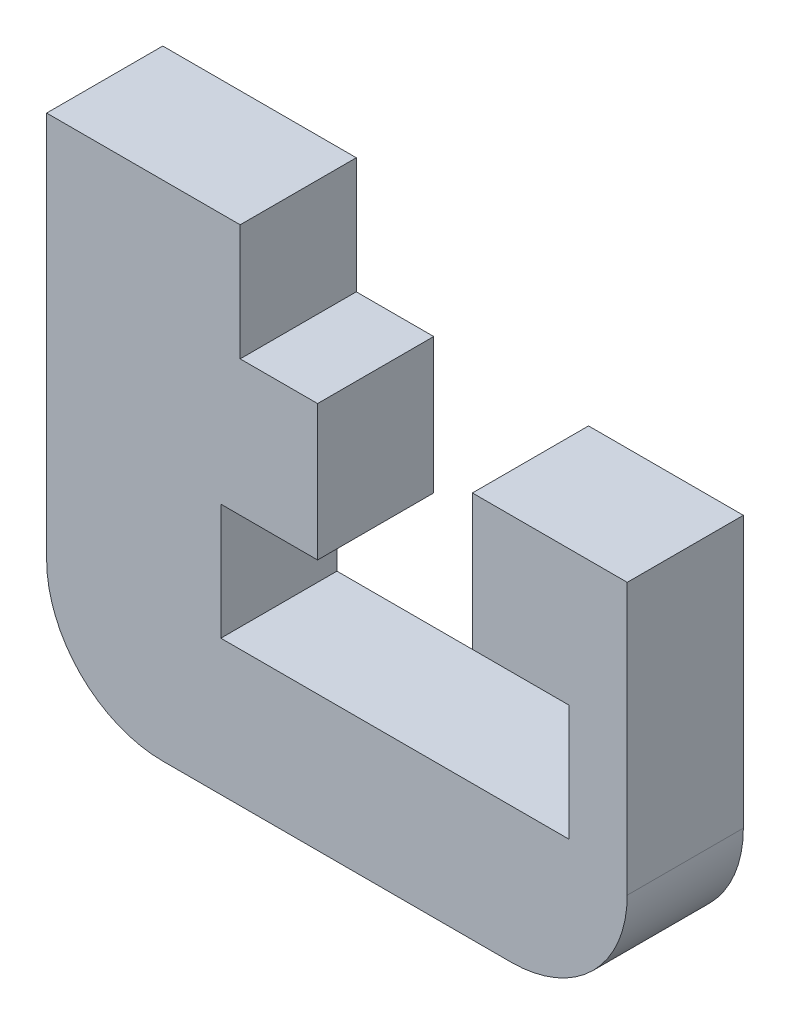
SolidWorks part; units mm, degrees
ref_plane "Alzado" through (0, 0, 0) normal (0, 0, 1) x (1, 0, 0)
ref_plane "Planta" through (0, 0, 0) normal (0, 1, 0) x (1, 0, 0)
ref_plane "Vista lateral" through (0, 0, 0) normal (1, 0, 0) x (0, 0, -1)
sketch "Croquis1" plane through (0, 0, 0) normal (0, 0, 1) x (1, 0, 0)
  line L0 (0, 22.001) -> (-5, 22.001)
  line L1 (-5, 22.001) -> (-5, 12.001)
  line L2 (6, 19.001) -> (10, 19.001)
  line L3 (10, 19.001) -> (10, 12.001)
  line L4 (6, 19.001) -> (6, 15.501)
  line L5 (6, 15.501) -> (8.5, 15.501)
  line L6 (8.5, 15.501) -> (8.5, 12.501)
  line L7 (8.5, 12.501) -> (-0.5, 12.501)
  line L8 (-0.5, 12.501) -> (-0.5, 15.501)
  line L9 (-0.5, 15.501) -> (2, 15.501)
  line L10 (2, 15.501) -> (2, 19.001)
  line L11 (2, 19.001) -> (0, 19.001)
  line L12 (0, 19.001) -> (0, 22.001)
  line L13 (7, 9.001) -> (-2, 9.001)
  arc A0 (-5, 12.001) -> (-2, 9.001) centre (-2, 12.001) ccw
  arc A1 (10, 12.001) -> (7, 9.001) centre (7, 12.001) cw
  dimension "D1" = 3
  dimension "D2" = 3
extrude "Saliente-Extruir1" add sketch "Croquis1" along normal blind 3
